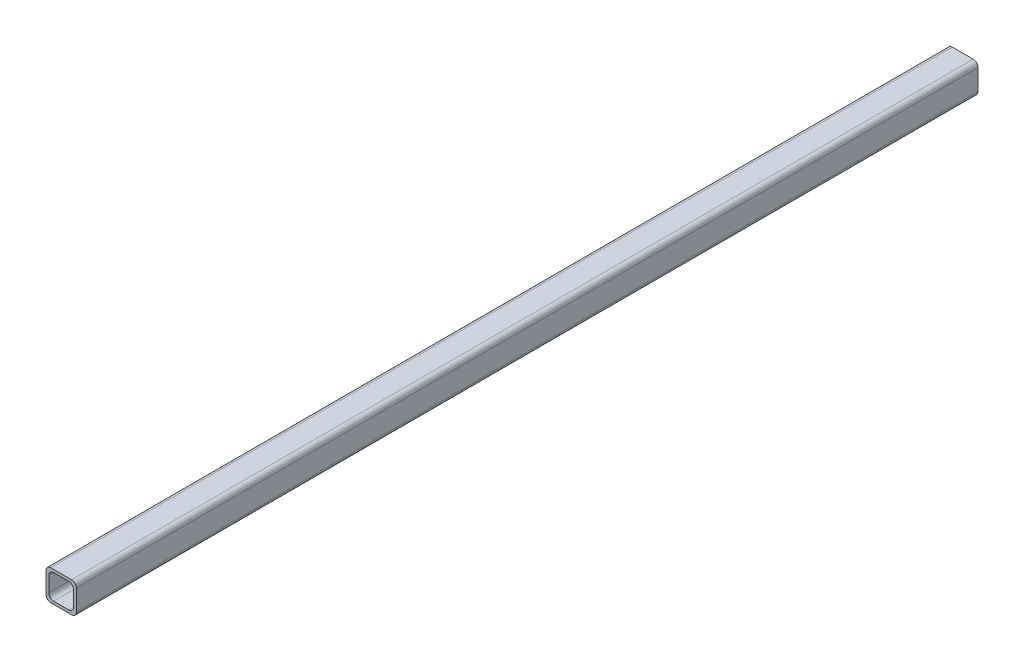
SolidWorks part; units mm, degrees
ref_plane "Plan1" through (0, 0, 0) normal (0, 0, 1) x (1, 0, 0)
ref_plane "Plan2" through (0, 0, 0) normal (0, 1, 0) x (1, 0, 0)
ref_plane "Plan3" through (0, 0, 0) normal (1, 0, 0) x (0, 0, -1)
sketch "Esquisse1" plane through (0, 0, 0) normal (0, 0, 1) x (1, 0, 0)
  line L0 (-5.5, 8) -> (5.5, 8)
  line L1 (-8, 5.5) -> (-8, -5.5)
  line L2 (5.5, -8) -> (-5.5, -8)
  line L3 (8, -5.5) -> (8, 5.5)
  line L4 (-4, 6.5) -> (4, 6.5)
  line L5 (-6.5, 4) -> (-6.5, -4)
  line L6 (4, -6.5) -> (-4, -6.5)
  line L7 (6.5, -4) -> (6.5, 4)
  line L8 (-48.7418, 0) -> (48.7418, 0) construction
  line L9 (0, 57.3432) -> (0, -57.3432) construction
  arc A0 (-4, 6.5) -> (-6.5, 4) centre (-4, 4) ccw
  arc A1 (6.5, 4) -> (4, 6.5) centre (4, 4) ccw
  arc A2 (6.5, -4) -> (4, -6.5) centre (4, -4) cw
  arc A3 (-6.5, -4) -> (-4, -6.5) centre (-4, -4) ccw
  arc A4 (-5.5, 8) -> (-8, 5.5) centre (-5.5, 5.5) ccw
  arc A5 (8, 5.5) -> (5.5, 8) centre (5.5, 5.5) ccw
  arc A6 (8, -5.5) -> (5.5, -8) centre (5.5, -5.5) cw
  arc A7 (-5.5, -8) -> (-8, -5.5) centre (-5.5, -5.5) cw
  dimension "D1" = 2.5
  dimension "D2" = 16
  dimension "D3" = 13
  dimension "D4" = 13
  dimension "D5" = 16
extrude "Base-Extrusion" add sketch "Esquisse1" along normal blind 475
